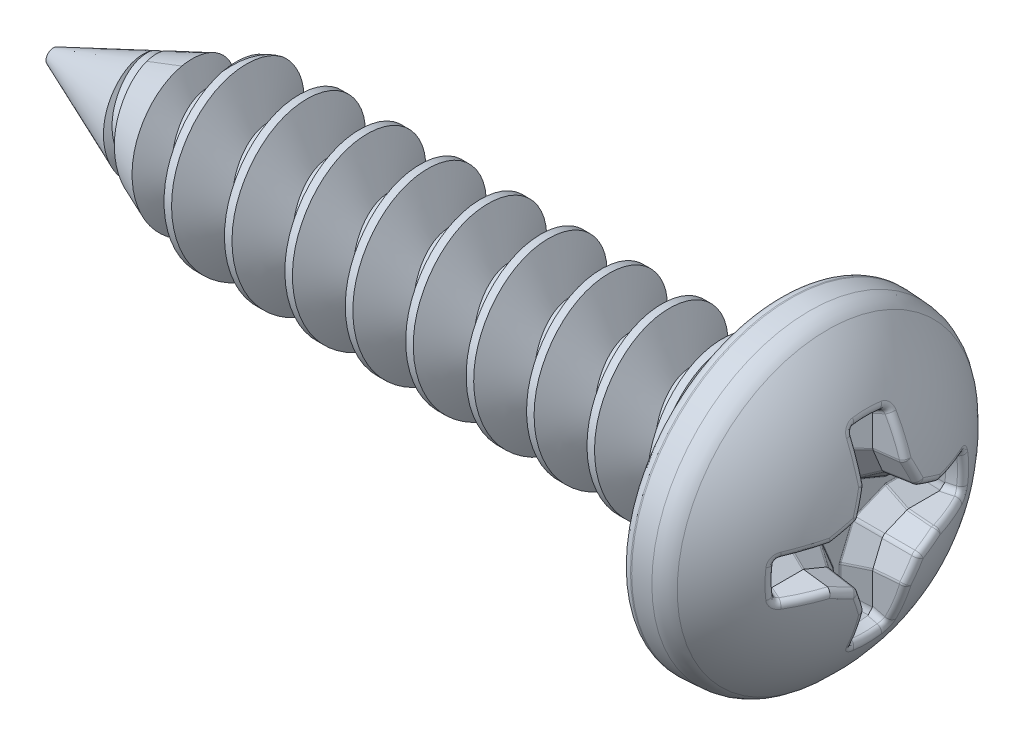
SolidWorks part; units mm, degrees
ref_plane "Plan de face" through (0, 0, 0) normal (0, 0, 1) x (1, 0, 0)
ref_plane "Plan de dessus" through (0, 0, 0) normal (0, 1, 0) x (1, 0, 0)
ref_plane "Plan de droite" through (0, 0, 0) normal (1, 0, 0) x (0, 0, -1)
mirrored part "vis phillips bombé cruciforme 3,5x12_Rendre symétrique"
other "<vis phillips bombé cruciforme 3,5x12>-<Importée1>"
